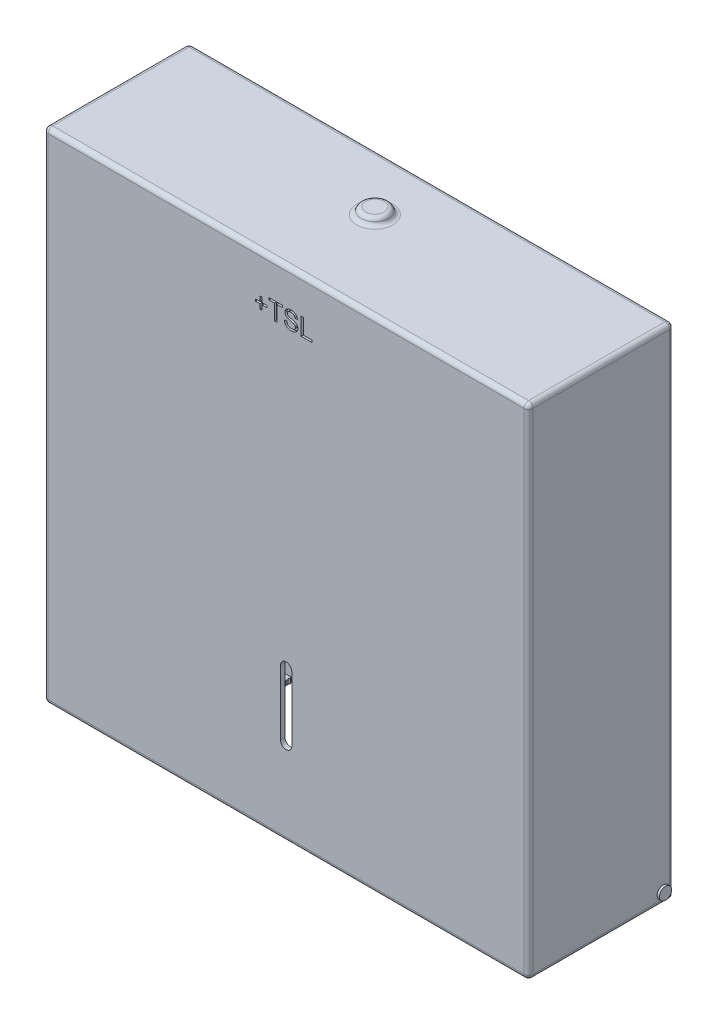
SolidWorks part; units mm, degrees
ref_plane "Front Plane" through (0, 0, 0) normal (0, 0, 1) x (1, 0, 0)
ref_plane "Top Plane" through (0, 0, 0) normal (0, 1, 0) x (1, 0, 0)
ref_plane "Right Plane" through (0, 0, 0) normal (1, 0, 0) x (0, 0, -1)
sketch "Sketch2" plane through (0, 0, 0) normal (0, 0, 1) x (1, 0, 0)
  line L1 (-135.9916, -139.9921) -> (135.9916, -139.9921)
  line L2 (-135.9916, -139.9921) -> (-135.9916, 139.9921)
  line L3 (-135.9916, 139.9921) -> (135.9916, 139.9921)
  line L4 (135.9916, -139.9921) -> (135.9916, 139.9921)
  line L5 (0, 139.9921) -> (0, -139.9921) construction
  line L6 (-135.9916, 0) -> (135.9916, 0) construction
  point P0 (0, 0)
  dimension "D1" = 271.9832
  dimension "D2" = 279.9842
extrude "Boss-Extrude1" add sketch "Sketch2" against normal blind 81.5605
shell "Shell2" thickness 2.54
fillet "Fillet1" radius 2.54 12 edges at (135.9916, 0, 0) (0, 139.9921, 0) (-135.9916, 0, 0) (0, -139.9921, 0) (135.9916, 0, -81.5605) (0, 139.9921, -81.5605) (-135.9916, 0, -81.5605) (0, -139.9921, -81.5605) (-135.9916, 139.9921, -40.7803) (-135.9916, -139.9921, -40.7803) (135.9916, -139.9921, -40.7803) (135.9916, 139.9921, -40.7803)
sketch "Sketch3" plane through (0, 0, 0) normal (0, 0, 1) x (1, 0, 0)
  text T0 "+TSL" font "Arial" height in points 38
extrude "Cut-Extrude1" cut sketch "Sketch3" against normal blind 1.27
sketch "Sketch4" plane through (0, 0, 0) normal (0, 0, 1) x (1, 0, 0)
  line L2 (-3.175, -91.9978) -> (-3.175, -55.4818)
  line L4 (3.175, -91.9978) -> (3.175, -55.4818)
  line L5 (0, -52.4383) -> (0, -95.0341) construction
  line L6 (-3.175, -73.7398) -> (3.175, -73.7398) construction
  line L7 (135.9916, 137.4521) -> (135.9916, -137.4521) construction
  arc A0 (-3.175, -91.9978) -> (3.175, -91.9978) centre (0, -91.8559) ccw
  arc A2 (-3.175, -55.4818) -> (3.175, -55.4818) centre (0, -55.6161) cw
  point P0 (0, -73.7398)
  dimension "D4" = 135.9916
extrude "Cut-Extrude4" cut sketch "Sketch4" against normal blind 13.97
sketch "Sketch6" plane through (0, 139.9921, 0) normal (0, 1, 0) x (1, 0, 0)
  line L0 (-135.9916, 2.54) -> (-135.9916, 79.0205) construction
  line L1 (-133.4516, 81.5605) -> (133.4516, 81.5605) construction
  circle A0 centre (0, 49.8105) radius 7.747
  dimension "D1" = 15.494
  dimension "D2" = 135.9916
  dimension "D3" = 31.75
extrude "Boss-Extrude2" add sketch "Sketch6" along normal blind 3.81
fillet "Fillet2" radius 2.54 1 edges at (0, 143.8021, -42.0635)
fillet "Fillet3" radius 2.54 1 edges at (0, 139.9921, -42.0635)
sketch "Sketch7" plane through (0, 0, -81.5605) normal (0, 0, -1) x (-1, 0, 0)
  line L0 (-135.9916, -137.4521) -> (-135.9916, 137.4521) construction
  line L1 (133.4516, -139.9921) -> (-133.4516, -139.9921) construction
  line L2 (135.9916, 137.4521) -> (135.9916, -137.4521) construction
  circle A0 centre (0, -57.4421) radius 3.429
  circle A1 centre (0, -32.0421) radius 1.7145
  circle A2 centre (0, -6.6421) radius 1.7145
  circle A3 centre (0, 18.7579) radius 3.429
  dimension "D1" = 6.858
  dimension "D4" = 3.429
  dimension "D7" = 6.858
  dimension "D8" = 3.429
  dimension "D2" = 135.9916
  dimension "D3" = 82.55
  dimension "D5" = 25.4
  dimension "D6" = 135.9916
  dimension "D9" = 25.4
  dimension "D10" = 25.4
  dimension "D11" = 135.9916
extrude "Cut-Extrude6" cut sketch "Sketch7" against normal blind 3.81
sketch "Sketch8" plane through (0, -139.9921, 0) normal (0, -1, 0) x (1, 0, 0)
  line L0 (133.4516, -2.54) -> (-133.4516, -2.54) construction
  line L1 (-76.3016, -2.54) -> (76.3016, -2.54)
  line L2 (-76.3016, -2.54) -> (-76.3016, -79.0205)
  line L3 (-76.3016, -79.0205) -> (76.3016, -79.0205)
  line L4 (76.3016, -2.54) -> (76.3016, -79.0205)
  line L5 (-76.3016, -2.54) -> (76.3016, -79.0205) construction
  line L6 (-76.3016, -79.0205) -> (76.3016, -2.54) construction
  line L7 (-133.4516, -79.0205) -> (133.4516, -79.0205) construction
  line L8 (133.4516, -79.0205) -> (133.4516, -2.54) construction
  line L9 (-133.4516, -2.54) -> (-133.4516, -79.0205) construction
  point P4 (0, -40.7803)
  dimension "D1" = 57.15
  dimension "D2" = 57.15
extrude "Cut-Extrude7" cut sketch "Sketch8" against normal blind 3.81
sketch "Sketch9" plane through (135.9916, 0, 0) normal (1, 0, 0) x (0, 0, -1)
  line L2 (2.54, -137.4521) -> (79.0205, -137.4521) construction
  line L3 (79.0205, -137.4521) -> (79.0205, 137.4521) construction
  circle A0 centre (75.5915, -134.0231) radius 3.429
  dimension "D1" = 6.858
extrude "Boss-Extrude3" add sketch "Sketch9" along normal blind 1.27
pattern_linear "LPattern3" count 2 spacing 273.05 along (-1, 0, 0) of "Boss-Extrude3"
sketch "Sketch12" plane through (0, -139.9921, 0) normal (0, -1, 0) x (1, 0, 0)
  line L0 (-76.3016, -2.54) -> (-76.3016, -79.0205) construction
  line L1 (-76.3016, -2.54) -> (-76.3016, -3.7402)
  line L6 (-75.7434, -3.1401) -> (-76.3016, -2.54)
  line L7 (-75.7434, -3.1401) -> (-76.3016, -3.7402)
  dimension "D1" = 0.5582
  dimension "D2" = 0.8196
extrude "Boss-Extrude4" add sketch "Sketch12" against normal blind 2.54
pattern_linear "LPattern4" count 60 spacing 1.27 along (0, 0, -1) of "Boss-Extrude4"
sketch "Sketch13" plane through (0, -139.9921, 0) normal (0, -1, 0) x (1, 0, 0)
  line L0 (76.3016, -2.54) -> (76.3016, -3.7517)
  line L1 (76.3016, -79.0205) -> (76.3016, -2.54) construction
  line L6 (76.3016, -2.54) -> (75.866, -3.1459)
  line L7 (75.866, -3.1459) -> (76.3016, -3.7517)
extrude "Boss-Extrude5" add sketch "Sketch13" against normal blind 2.54
pattern_linear "LPattern5" count 60 spacing 1.27 along (0, 0, -1) of "Boss-Extrude5"
sketch "Sketch14" plane through (0, 0, -81.5605) normal (0, 0, -1) x (-1, 0, 0)
  line L5 (-76.3016, -139.9921) -> (-133.4516, -139.9921) construction
  line L6 (-135.9916, -134.0231) -> (-135.9916, 137.4521) construction
  line L11 (-100.0506, -95.7961) -> (-100.0506, -95.8074) construction
  line L13 (-103.2256, -105.0288) -> (-103.2256, -98.9824)
  line L15 (-96.8756, -105.0288) -> (-96.8756, -98.9824)
  line L17 (-100.0506, -104.1781) -> (-100.0506, -106.3371) construction
  arc A1 (-103.2256, -98.9824) -> (-96.8756, -98.9824) centre (-100.0506, -98.9824) cw
  arc A2 (-103.2256, -105.0288) -> (-96.8756, -105.0288) centre (-100.0506, -110.5281) ccw
  point P4 (-100.0506, -106.3371)
  point P7 (-100.0506, -106.3371)
  dimension "D2" = 35.941
  dimension "D1" = 29.464
extrude "Cut-Extrude8" cut sketch "Sketch14" against normal blind 2.54
pattern_linear "LPattern6" count 2 spacing 199.9996 along (-1, 0, 0) of "Cut-Extrude8"
pattern_linear "LPattern7" count 2 spacing 199.9996 along (0, 1, 0) of "LPattern6", "Cut-Extrude8"
